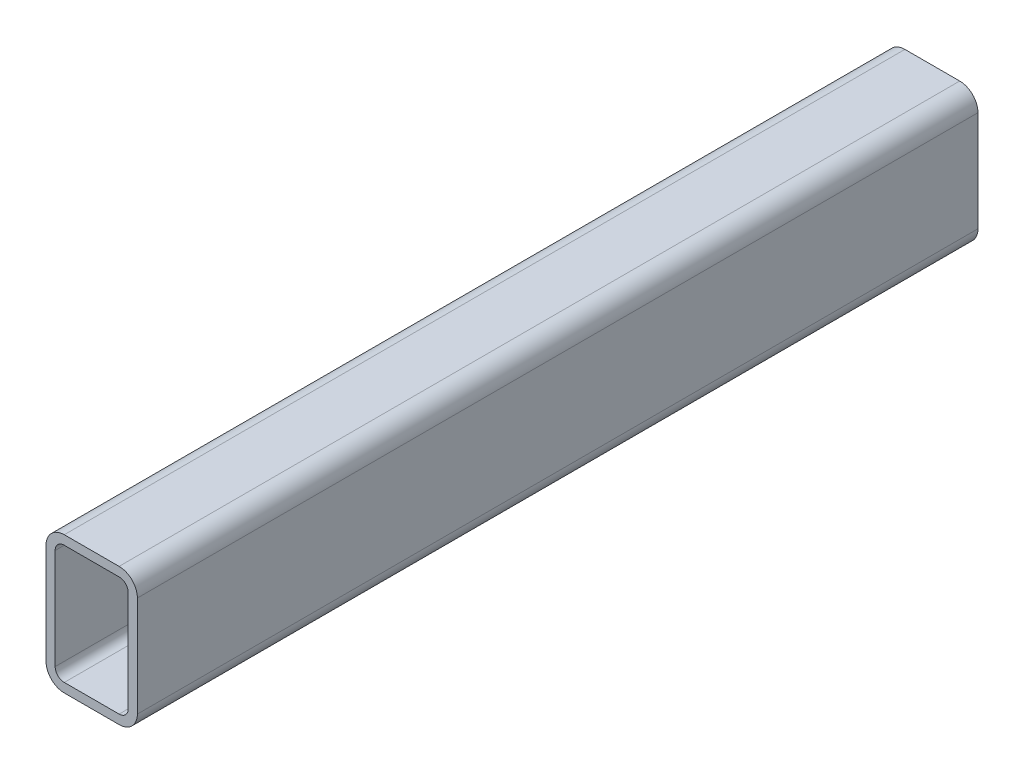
SolidWorks part; units mm, degrees
ref_plane "Plan de face" through (0, 0, 0) normal (0, 0, 1) x (1, 0, 0)
ref_plane "Plan de dessus" through (0, 0, 0) normal (0, 1, 0) x (1, 0, 0)
ref_plane "Plan de droite" through (0, 0, 0) normal (1, 0, 0) x (0, 0, -1)
sketch "Esquisse1" plane through (0, 0, 0) normal (0, 0, 1) x (1, 0, 0)
  line L0 (20, 0) -> (80, 0)
  line L1 (100, 20) -> (100, 130)
  line L2 (80, 150) -> (20, 150)
  line L3 (0, 130) -> (0, 20)
  line L4 (80, 140) -> (20, 140)
  line L5 (10, 130) -> (10, 20)
  line L6 (20, 10) -> (80, 10)
  line L7 (90, 20) -> (90, 130)
  arc A0 (80, 0) -> (100, 20) centre (80, 20) ccw
  arc A1 (100, 130) -> (80, 150) centre (80, 130) ccw
  arc A2 (20, 150) -> (0, 130) centre (20, 130) ccw
  arc A3 (0, 20) -> (20, 0) centre (20, 20) ccw
  arc A4 (20, 140) -> (10, 130) centre (20, 130) ccw
  arc A5 (10, 20) -> (20, 10) centre (20, 20) ccw
  arc A6 (80, 10) -> (90, 20) centre (80, 20) ccw
  arc A7 (90, 130) -> (80, 140) centre (80, 130) ccw
  dimension "D3" = 20
  dimension "D1" = 100
  dimension "D2" = 150
  dimension "D4" = 10
extrude "Extrusion1" add sketch "Esquisse1" along normal mid plane 920
